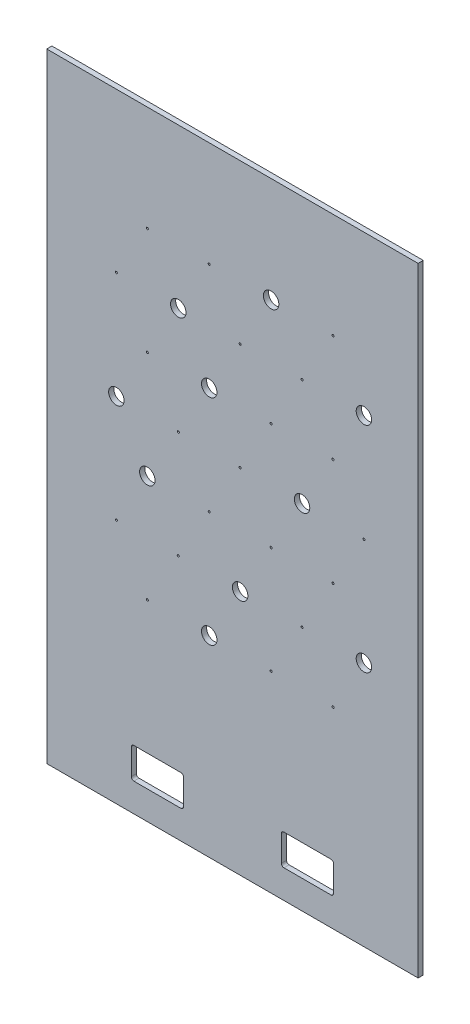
SolidWorks part; units mm, degrees
ref_plane "Front Plane" through (0, 0, 0) normal (0, 0, 1) x (1, 0, 0)
ref_plane "Top Plane" through (0, 0, 0) normal (0, 1, 0) x (1, 0, 0)
ref_plane "Right Plane" through (0, 0, 0) normal (1, 0, 0) x (0, 0, -1)
sketch "Sketch2" plane through (0, 0, 0) normal (0, 0, 1) x (1, 0, 0)
  line L1 (-457.2, -609.6) -> (457.2, -609.6)
  line L2 (-457.2, -609.6) -> (-457.2, 609.6)
  line L3 (-457.2, 609.6) -> (457.2, 609.6)
  line L4 (457.2, -609.6) -> (457.2, 609.6)
  line L5 (-457.2, -609.6) -> (457.2, 609.6) construction
  line L6 (-457.2, 609.6) -> (457.2, -609.6) construction
  point P0 (0, 0)
  dimension "D1" = 914.4
  dimension "D2" = 1219.2
extrude "Boss-Extrude1" add sketch "Sketch2" along normal mid plane 12.7
sketch "Sketch4" plane through (0, 0, 6.35) normal (0, 0, 1) x (1, 0, 0)
  line L0 (-438.15, 609.6) -> (-438.15, -609.6) construction
  line L1 (457.2, 609.6) -> (-457.2, 609.6) construction
  line L2 (-457.2, -609.6) -> (457.2, -609.6) construction
  line L3 (-438.15, -1092.2) -> (-438.15, 609.6) construction
  line L4 (438.15, 609.6) -> (438.15, -609.6) construction
  line L5 (438.15, 609.6) -> (438.15, -1092.2) construction
  line L6 (-438.15, 609.6) -> (438.15, 609.6) construction
  line L7 (-438.15, -609.6) -> (438.15, -609.6) construction
other "Fill Pattern1" parameters "D10"=5.08, "D5"=0, "D6"=0, "D1"=152.4, "D2"=60, "D3"=0, "D9"=31
sketch "Sketch5" plane through (0, -609.6, 0) normal (0, -1, 0) x (1, 0, 0)
  line L4 (-457.2, -6.35) -> (457.2, -6.35)
  line L5 (457.2, -6.35) -> (457.2, 6.35)
  line L6 (457.2, 6.35) -> (-457.2, 6.35)
  line L7 (-457.2, 6.35) -> (-457.2, -6.35)
  line L8 (-457.2, -6.35) -> (457.2, -6.35)
  line L9 (457.2, -6.35) -> (457.2, 6.35)
  line L10 (457.2, 6.35) -> (-457.2, 6.35)
  line L11 (-457.2, 6.35) -> (-457.2, -6.35)
  dimension "D1" = 0
extrude "Boss-Extrude2" add sketch "Sketch5" along normal up to surface (177.8 mm away)
sketch "Sketch6" plane through (0, 0, 6.35) normal (0, 0, 1) x (1, 0, 0)
  line L0 (0, 0) -> (0, -50000) construction
  line L1 (-249.0978, -641.35) -> (-120.5185, -641.35)
  line L2 (-249.0978, -641.35) -> (-249.0978, -717.55)
  line L3 (-249.0978, -717.55) -> (-120.5185, -717.55)
  line L4 (-120.5185, -641.35) -> (-120.5185, -717.55)
  line L5 (-249.0978, -641.35) -> (-120.5185, -717.55) construction
  line L6 (-249.0978, -717.55) -> (-120.5185, -641.35) construction
  line L7 (-107.8185, -628.65) -> (-107.8185, -788.1874) construction
  line L8 (-120.5185, -679.45) -> (-107.8185, -679.45) construction
  line L9 (-249.0978, -679.45) -> (-261.7978, -679.45) construction
  line L10 (-261.7978, -628.65) -> (-261.7978, -788.1874) construction
  line L11 (-299.8978, -628.65) -> (-69.7185, -628.65) construction
  line L12 (249.0978, -641.35) -> (249.0978, -717.55)
  line L13 (249.0978, -641.35) -> (120.5185, -641.35)
  line L14 (120.5185, -641.35) -> (120.5185, -717.55)
  line L15 (249.0978, -717.55) -> (120.5185, -717.55)
  point P0 (-184.8081, -679.45)
  dimension "D1" = 12.7
  dimension "D2" = 76.2
  dimension "D3" = 12.7
extrude "Cut-Extrude1" cut sketch "Sketch6" against normal through all
sketch "Sketch7" plane through (0, 609.6, 0) normal (0, 1, 0) x (1, 0, 0)
  line L4 (457.2, 6.35) -> (-457.2, 6.35)
  line L5 (-457.2, 6.35) -> (-457.2, -6.35)
  line L6 (-457.2, -6.35) -> (457.2, -6.35)
  line L7 (457.2, -6.35) -> (457.2, 6.35)
  line L8 (457.2, 6.35) -> (-457.2, 6.35)
  line L9 (-457.2, 6.35) -> (-457.2, -6.35)
  line L10 (-457.2, -6.35) -> (457.2, -6.35)
  line L11 (457.2, -6.35) -> (457.2, 6.35)
  dimension "D1" = 0
extrude "Boss-Extrude3" add sketch "Sketch7" along normal up to surface (127 mm away)
fillet "Fillet2" radius 6.35 8 edges at (249.0978, -717.55, 0) (249.0978, -641.35, 0) (120.5185, -641.35, 0) (120.5185, -717.55, 0) (-249.0978, -717.55, 0) (-120.5185, -717.55, 0) (-120.5185, -641.35, 0) (-249.0978, -641.35, 0)
sketch "Sketch9" plane through (0, 0, 6.35) normal (0, 0, 1) x (1, 0, 0)
  circle A0 centre (95.25, 477.6177) radius 19.05
  circle A1 centre (-133.35, 345.6355) radius 19.05
  circle A2 centre (323.85, 345.6355) radius 19.05
  circle A3 centre (-209.55, -50.3114) radius 19.05
  circle A5 centre (323.85, -182.2936) radius 19.05
  circle A6 centre (-57.15, -314.2759) radius 19.05
  circle A7 centre (19.05, -182.2936) radius 19.05
  circle A8 centre (-57.15, 213.6532) radius 19.05
  circle A9 centre (171.45, 81.6709) radius 19.05
  circle A10 centre (-285.75, 81.6709) radius 19.05
  dimension "D1" = 38.1
extrude "Cut-Extrude2" cut sketch "Sketch9" against normal through all
sketch "Sketch10" plane through (0, 0, 6.35) normal (0, 0, 1) x (1, 0, 0)
  circle A0 centre (-209.55, -314.2759) radius 2.54 construction
  circle A1 centre (-57.15, -314.2759) radius 19.05 construction
  circle A2 centre (95.25, -314.2759) radius 2.54 construction
  circle A3 centre (247.65, -314.2759) radius 2.54 construction
  circle A4 centre (323.85, -182.2936) radius 19.05 construction
  circle A5 centre (171.45, -182.2936) radius 2.54 construction
  circle A6 centre (19.05, -182.2936) radius 19.05 construction
  circle A7 centre (-133.35, -182.2936) radius 2.54 construction
  circle A8 centre (-285.75, -182.2936) radius 2.54 construction
  circle A9 centre (-57.15, -50.3114) radius 2.54 construction
  circle A10 centre (-209.55, -50.3114) radius 19.05 construction
  circle A11 centre (95.25, -50.3114) radius 2.54 construction
  circle A12 centre (247.65, -50.3114) radius 2.54 construction
  circle A13 centre (323.85, 81.6709) radius 2.54 construction
  circle A14 centre (171.45, 81.6709) radius 19.05 construction
  circle A15 centre (19.05, 81.6709) radius 2.54 construction
  circle A16 centre (-133.35, 81.6709) radius 2.54 construction
  circle A17 centre (-285.75, 81.6709) radius 19.05 construction
  circle A18 centre (-209.55, 213.6532) radius 2.54 construction
  circle A19 centre (-57.15, 213.6532) radius 19.05 construction
  circle A20 centre (95.25, 213.6532) radius 2.54 construction
  circle A21 centre (247.65, 213.6532) radius 2.54 construction
  circle A22 centre (323.85, 345.6355) radius 19.05 construction
  circle A23 centre (171.45, 345.6355) radius 2.54 construction
  circle A24 centre (19.05, 345.6355) radius 2.54 construction
  circle A25 centre (-133.35, 345.6355) radius 19.05 construction
  circle A26 centre (-285.75, 345.6355) radius 2.54 construction
  circle A27 centre (-209.55, 477.6177) radius 2.54 construction
  circle A28 centre (-57.15, 477.6177) radius 2.54 construction
  circle A29 centre (95.25, 477.6177) radius 19.05 construction
  circle A30 centre (247.65, 477.6177) radius 2.54 construction
  circle A31 centre (-209.55, -314.2759) radius 2.54
  circle A32 centre (-57.15, -314.2759) radius 19.05
  circle A33 centre (95.25, -314.2759) radius 2.54
  circle A34 centre (247.65, -314.2759) radius 2.54
  circle A35 centre (323.85, -182.2936) radius 19.05
  circle A36 centre (171.45, -182.2936) radius 2.54
  circle A37 centre (19.05, -182.2936) radius 19.05
  circle A38 centre (-133.35, -182.2936) radius 2.54
  circle A39 centre (-285.75, -182.2936) radius 2.54
  circle A40 centre (-57.15, -50.3114) radius 2.54
  circle A41 centre (-209.55, -50.3114) radius 19.05
  circle A42 centre (95.25, -50.3114) radius 2.54
  circle A43 centre (247.65, -50.3114) radius 2.54
  circle A44 centre (323.85, 81.6709) radius 2.54
  circle A45 centre (171.45, 81.6709) radius 19.05
  circle A46 centre (19.05, 81.6709) radius 2.54
  circle A47 centre (-133.35, 81.6709) radius 2.54
  circle A48 centre (-285.75, 81.6709) radius 19.05
  circle A49 centre (-209.55, 213.6532) radius 2.54
  circle A50 centre (-57.15, 213.6532) radius 19.05
  circle A51 centre (95.25, 213.6532) radius 2.54
  circle A52 centre (247.65, 213.6532) radius 2.54
  circle A53 centre (323.85, 345.6355) radius 19.05
  circle A54 centre (171.45, 345.6355) radius 2.54
  circle A55 centre (19.05, 345.6355) radius 2.54
  circle A56 centre (-133.35, 345.6355) radius 19.05
  circle A57 centre (-285.75, 345.6355) radius 2.54
  circle A58 centre (-209.55, 477.6177) radius 2.54
  circle A59 centre (-57.15, 477.6177) radius 2.54
  circle A60 centre (95.25, 477.6177) radius 19.05
  circle A61 centre (247.65, 477.6177) radius 2.54
equation "\"diameter_plinko_rod_Cut\"=0.2"
equation "\"D10@Fill Pattern1\"=\"diameter_plinko_rod_Cut\""
